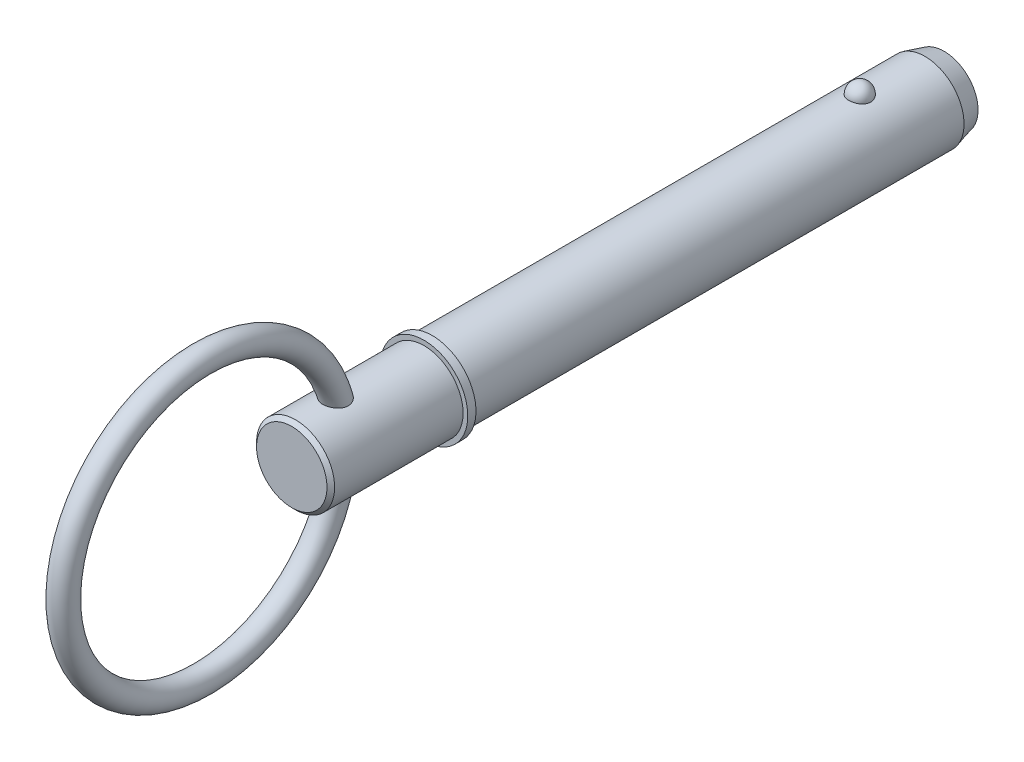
SolidWorks part; units mm, degrees
ref_plane "Front Plane" through (0, 0, 0) normal (0, 0, 1) x (1, 0, 0)
ref_plane "Top Plane" through (0, 0, 0) normal (0, 1, 0) x (1, 0, 0)
ref_plane "Right Plane" through (0, 0, 0) normal (1, 0, 0) x (0, 0, -1)
sketch "Sketch2" plane through (0, 0, 0) normal (0, 0, 1) x (1, 0, 0)
  circle A0 centre (0, 0) radius 7.145
  point P3 (0, 7.145)
  dimension "D1" = 14.29
extrude "Boss-Extrude1" add sketch "Sketch2" along normal blind 76.2
sketch "Sketch3" plane through (0, 0, 0) normal (0, 0, -1) x (-1, 0, 0)
  circle A0 centre (0, 0) radius 7.145
  dimension "D1" = 14.29
extrude "Boss-Extrude2" add sketch "Sketch3" along normal blind 17.45
chamfer "Chamfer1" distance 3.5 angle 15 1 edges at (-7.145, 0, -17.45)
sketch "Sketch18" plane through (0, 0, 0) normal (1, 0, 0) x (0, 0, -1)
  line L0 (13.95, 7.145) -> (-76.2, 7.145) construction
  line L1 (2.02, 9.165) -> (2.02, 5.125)
  line L2 (-76.2, -7.145) -> (13.95, -7.145) construction
  arc A0 (2.02, 9.165) -> (2.02, 5.125) centre (2.02, 7.145) ccw
  point P4 (0, 7.145)
  dimension "D1" = 16.31
revolve "Revolve1" add sketch "Sketch18" angle 360 about L1
sketch "Sketch19" plane through (0, 0, 0) normal (1, 0, 0) x (0, 0, -1)
  line L0 (-33.7288, 0) -> (-46.4542, 0) construction
sketch "Sketch20" plane through (0, 0, 0) normal (1, 0, 0) x (0, 0, -1)
  line L0 (-76.2, 0) -> (-76.2, 8)
  line L1 (-76.2, 7.145) -> (-76.2, -7.145) construction
  line L2 (-76.2, 8) -> (-77.7, 8)
  line L3 (-77.7, 8) -> (-77.7, 0)
  line L4 (-33.7288, 0) -> (-46.4542, 0) construction
  line L5 (-77.7, 0) -> (-76.2, 0)
  dimension "D1" = 8
  dimension "D2" = 1.5
revolve "Revolve2" add sketch "Sketch20" angle 360 about L0
sketch "Sketch21" plane through (0, 0, 76.2) normal (0, 0, -1) x (-1, 0, 0)
  circle A0 centre (0, 0) radius 7.145
  dimension "D1" = 14.29
extrude "Boss-Extrude3" add sketch "Sketch21" against normal blind 25.7
chamfer "Chamfer2" distance 0.7 angle 45 1 edges at (-7.145, 0, 101.9)
sketch "Sketch23" plane through (0, 0, 0) normal (1, 0, 0) x (0, 0, -1)
  line L0 (-101.9, 6.445) -> (-101.9, -6.445) construction
  circle A0 centre (-118.3, 0) radius 25.4
  point P2 (-92.9, 0)
  dimension "D1" = 50.8
  dimension "D2" = 9
sketch "Sketch24" plane through (0, 0, 0) normal (0, 1, 0) x (1, 0, 0)
  circle A0 centre (0, -92.9) radius 2.25
  dimension "D1" = 4.5
sweep "Sweep1" add profiles "Sketch24" path "Sketch23"
